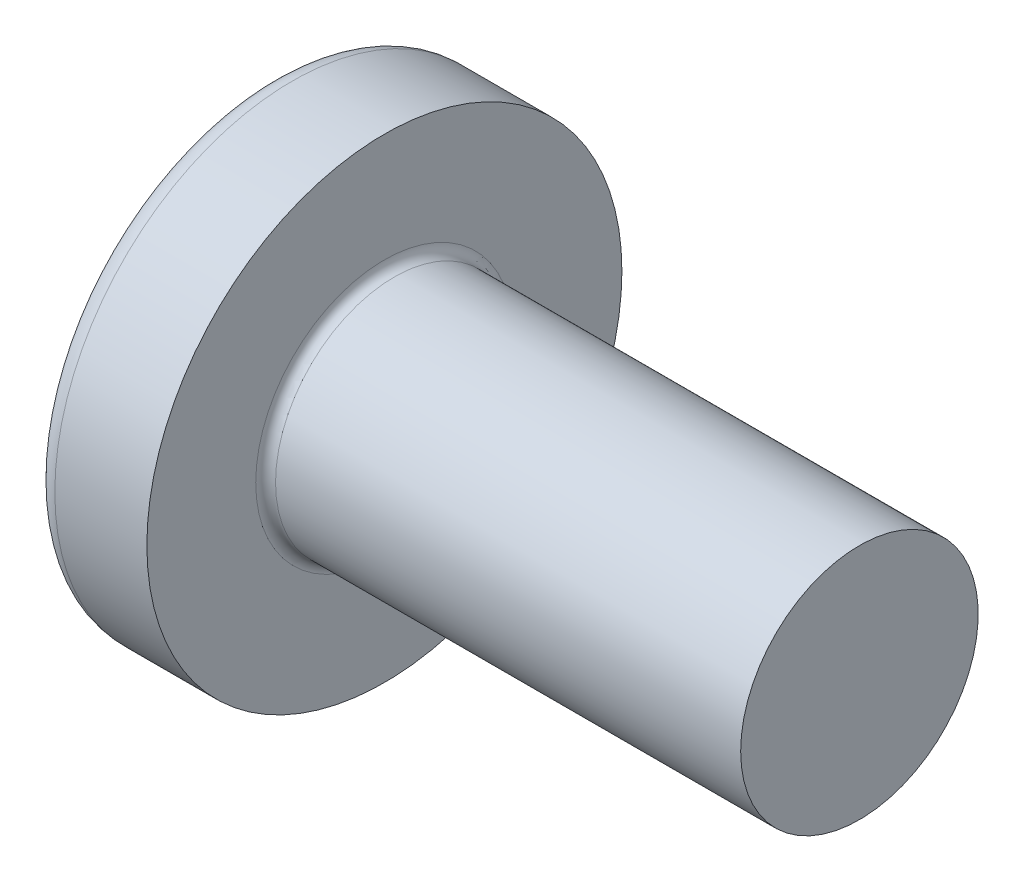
SolidWorks part; units mm, degrees
ref_plane "Plane1" through (0, 0, 0) normal (0, 0, 1) x (1, 0, 0)
ref_plane "Plane2" through (0, 0, 0) normal (0, 1, 0) x (1, 0, 0)
ref_plane "Plane3" through (0, 0, 0) normal (1, 0, 0) x (0, 0, -1)
sketch "BodySke" plane through (0, 0, 0) normal (0, 0, 1) x (1, 0, 0)
  line L0 (4.6, 3) -> (4.6, 6)
  line L1 (5.1, 6.35) -> (5.1, -3.175) construction
  line L2 (-25.4, 0) -> (127, 0) construction
  line L3 (16.6, 0) -> (0, 0)
  line L4 (4.6, 3) -> (16.6, 3)
  line L5 (16.6, 3) -> (16.6, 0)
  line L6 (2.2747, 6) -> (4.6, 6)
  line L8 (4.6, 6.35) -> (4.6, -3.175) construction
  arc A0 (1.8337, 5.7717) -> (0, 0) centre (10, 0) ccw
  arc A2 (1.8337, 5.7717) -> (2.2747, 6) centre (2.2747, 5.46) cw
revolve "Base-Revolve" add sketch "BodySke"
fillet "Fillet1" radius 0.25 1 edges at (4.6, 0, 3)
sketch "Sketch3" plane through (0, 0, 0) normal (1, 0, 0) x (0, 0, -1)
  line L0 (0.71, -3.35) -> (-0.71, -3.35)
  line L1 (0.71, -3.35) -> (0.71, 3.35)
  line L2 (-0.71, 3.35) -> (0.71, 3.35)
  line L3 (-0.71, 3.35) -> (-0.71, -3.35)
ref_plane "Plane4" through (3.46, 0, 0) normal (1, 0, 0) x (0, 0, -1)
sketch "Sketch4" plane through (3.46, 0, 0) normal (1, 0, 0) x (0, 0, -1)
  line L0 (0.71, -1.6249) -> (-0.71, -1.6249)
  line L1 (0.71, -1.6249) -> (0.71, 1.6249)
  line L2 (-0.71, 1.6249) -> (0.71, 1.6249)
  line L3 (-0.71, 1.6249) -> (-0.71, -1.6249)
loft "Recess" cut profiles "Sketch3", "Sketch4"
pattern_circular "RecPat" count 2 every 90 about axis through (0, 0, 0) along (1, 0, 0) of "Recess"
sketch "RecCorSke" plane through (0, 0, 0) normal (0, 0, 1) x (1, 0, 0)
  line L0 (-3.175, 0) -> (15.875, 0) construction
  line L1 (-25.4, 0) -> (127, 0) construction
  line L2 (0, 0) -> (0, 1.5224)
  line L3 (0, 1.5224) -> (3.46, 1.2805)
  line L4 (3.46, 1.2805) -> (3.8761, 0)
  line L5 (3.8761, 0) -> (0, 0)
revolve "RecessCore" cut sketch "RecCorSke" angle 360 about L0
sketch "ThdSchSke" plane through (0, 0, 0) normal (0, 0, 1) x (1, 0, 0)
  line L0 (6.6, -2.4455) -> (6.2117, -3)
  line L1 (6.6, -2.4455) -> (6.9883, -3)
  line L2 (6.9883, -3) -> (6.9883, -3.75)
  line L3 (-3.175, 0) -> (5.1513, 0) construction
  line L5 (6.9883, -3.75) -> (6.2117, -3.75)
  line L6 (6.2117, -3.75) -> (6.2117, -3)
revolve "ThreadSchematic" [suppressed] cut sketch "ThdSchSke" angle 360 about L3
pattern_linear "ThdSchPat" [suppressed]
equation "\"D1@Sketch3\" = \"Cross_dia@Sketch3\" / 2"
equation "\"D2@Sketch3\" = \"Cross_width@Sketch3\" / 2"
equation "\"Depth@RecCorSke\" = \"Cross_depth@Plane4\""
equation "\"D1@Sketch4\" = \"Cross_width@Sketch3\""
equation "\"D2@Sketch4\" = \"Cross_dia@Sketch3\" - 2.0 * \"Cross_depth@Plane4\" * tan(26.5  * 0.017453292)"
equation "\"D3@Sketch4\" = \"D1@Sketch4\" / 2"
equation "\"D4@Sketch4\" = \"D2@Sketch4\" / 2"
equation "\"Thread_length@ThreadCosmetic\" = ((sgn( (\"Length@BodySke\" - \"Advance@BodySke\" * 2.0 ) - \"Thread_nom@BodySke\" )-1)*( (\"Length@BodySke\" - \"Advance@BodySke\" * 2.0 ) - \"Thread_nom@BodySke\" ))/-2+ \"Thread_"
equation "\"Thread_minor@ThdSchSke\" = \"Thread_minor@ThreadCosmetic\""
equation "\"Diameter@ThdSchSke\" = \"Diameter@BodySke\""
equation "\"Overcut@ThdSchSke\" = \"Diameter@BodySke\" * 1.25"
equation "\"Start@ThdSchSke\" = \"Head_ht@BodySke\" + \"Length@BodySke\" - \"Thread_length@ThreadCosmetic\"  '---Non-countersunk---"
equation "\"Num_threads@ThdSchPat\" = int( \"Thread_length@ThreadCosmetic\" / \"Advance@BodySke\" + 0.999 )  + 1"
equation "\"Advance@ThdSchPat\" = \"Thread_length@ThreadCosmetic\" /  (\"Num_threads@ThdSchPat\" - 1) 'relax it"
